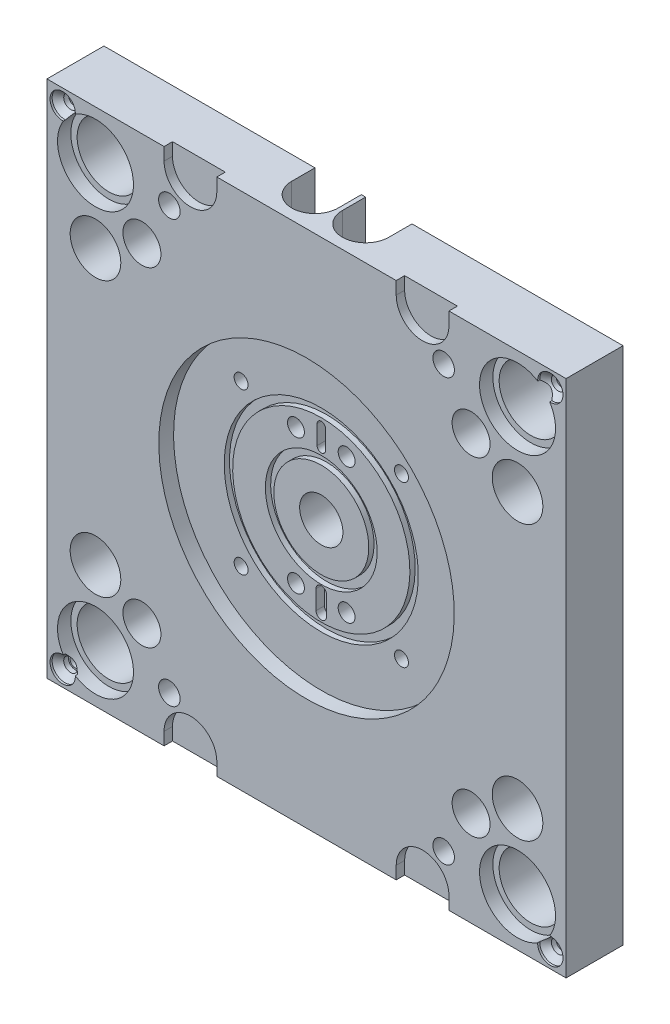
SolidWorks part; units mm, degrees
other "Objet de détail4"
ref_plane "Plan de face" through (0, 0, 0) normal (0, 0, 1) x (1, 0, 0)
ref_plane "Plan de dessus" through (0, 0, 0) normal (0, 1, 0) x (1, 0, 0)
ref_plane "Plan de droite" through (0, 0, 0) normal (1, 0, 0) x (0, 0, -1)
sketch "Esquisse1" plane through (0, 0, 0) normal (0, 0, 1) x (1, 0, 0)
  line L1 (-123, 123) -> (123, 123)
  line L2 (-123, 123) -> (-123, -123)
  line L3 (-123, -123) -> (123, -123)
  line L4 (123, 123) -> (123, -123)
  dimension "D1" = 246
  dimension "D2" = 246
  dimension "D3" = 123
  dimension "D4" = 123
extrude "ExtrusionPlaque" add sketch "Esquisse1" along normal blind 27
sketch "Esquisse2" plane through (0, 0, 0) normal (1, 0, 0) x (0, 0, -1)
  line L0 (2.3658, 0) -> (-28.3416, 0) construction
  line L1 (0, 10.25) -> (-20, 10.25)
  line L2 (0, -123) -> (0, 123) construction
  line L3 (-20, 10.25) -> (-20, 22.5)
  line L4 (-20, 22.5) -> (-17.5, 22.5)
  line L5 (-17.5, 22.5) -> (-17.5, 26.5)
  line L6 (-17.5, 26.5) -> (-20, 26.5)
  line L7 (-20, 26.5) -> (-20, 42)
  line L8 (-20, 42) -> (-17.5, 42)
  line L9 (-17.5, 42) -> (-17.5, 46)
  line L10 (-17.5, 46) -> (-20, 46)
  line L11 (-20, 46) -> (-20, 70)
  line L12 (-20, 70) -> (-27, 70)
  line L13 (-27, -123) -> (-27, 123) construction
  line L14 (-27, 70) -> (-27, 0)
  line L15 (0, 0) -> (-27, 0)
  line L16 (0, 0) -> (0, 10.25)
  dimension "D1" = 20.5
  dimension "D2" = 7
  dimension "D3" = 2.5
  dimension "D4" = 45
  dimension "D5" = 53
  dimension "D6" = 140
  dimension "D7" = 92
  dimension "D8" = 84
revolve "LogementBlocEtJoints" cut sketch "Esquisse2" angle 360 about L0
hole_wizard "ChambrageDouille" positions "Esquisse4" profile "Esquisse3" counterbore size "24" standard "HASCO Metric"
sketch "Esquisse4" plane through (0, 0, 27) normal (0, 0, 1) x (1, 0, 0)
  point P0 (-100, 100)
sketch "Esquisse3" plane through (-100, 100, 27) normal (1, 0, 0) x (0, -1, 0)
  line L0 (0, 0) -> (0, 27)
  line L1 (0, 27) -> (15, 27)
  line L3 (15, 27) -> (15, 6.3)
  line L4 (15, 6.3) -> (18, 6.3)
  line L5 (18, 6.3) -> (18, 0)
  line L7 (18, 0) -> (0, 0)
  line L11 (0, -6.35) -> (0, 107.95) construction
  dimension "Diamètre du perçage jusqu'au prochain" = 30
  dimension "Profondeur du perçage jusqu'au prochain" = 27
  dimension "Diamètre du chambrage" = 36
  dimension "Profondeur du chambrage" = 6.3
pattern_linear "RépétitionChamDouille" count 2 spacing 200 along (1, 0, 0) count 2 spacing 200 along (0, -1, 0) of "ChambrageDouille"
hole_wizard "Chambrage pour Vis épaulée 16 mm1" positions "Esquisse6" profile "Esquisse5" counterbore size "16" standard "HASCO Metric"
sketch "Esquisse6" plane through (0, 0, 27) normal (0, 0, 1) x (1, 0, 0)
  point P0 (-100, 65)
sketch "Esquisse5" plane through (-100, 65, 27) normal (1, 0, 0) x (0, -1, 0)
  line L0 (0, 0) -> (0, 27)
  line L1 (0, 27) -> (8.5, 27)
  line L3 (8.5, 27) -> (8.5, 17)
  line L4 (8.5, 17) -> (12, 17)
  line L5 (12, 17) -> (12, 0)
  line L7 (12, 0) -> (0, 0)
  line L11 (0, -6.35) -> (0, 107.95) construction
  dimension "Diamètre du perçage jusqu'au prochain" = 17
  dimension "Profondeur du perçage jusqu'au prochain" = 27
  dimension "Diamètre du chambrage" = 24
  dimension "Profondeur du chambrage" = 17
pattern_linear "RépétitionChambrage" count 2 spacing 200 along (1, 0, 0) count 2 spacing 130 along (0, -1, 0) of "Chambrage pour Vis épaulée 16 mm1"
hole_wizard "Fraisage pour vis à tête fraisée M101" positions "Esquisse8" profile "Esquisse7" countersink size "M10" standard "HASCO Metric"
sketch "Esquisse8" plane through (0, 0, 27) normal (0, 0, 1) x (1, 0, 0)
  point P0 (-115.555, 115.555)
sketch "Esquisse7" plane through (-115.555, 115.555, 27) normal (1, 0, 0) x (0, -1, 0)
  line L0 (0, 0) -> (0, 6)
  line L1 (0, 6) -> (3.25, 6)
  line L2 (3.25, 6) -> (3.25, 3.75)
  line L3 (3.25, 3.75) -> (6, 1)
  line L4 (6, 1) -> (6, 0)
  line L6 (6, 0) -> (0, 0)
  line L7 (-3.25, 3.75) -> (-6, 1) construction
  line L10 (0, 6) -> (-3.25, 6) construction
  line L11 (0, -6.35) -> (0, 107.95) construction
  dimension "Diamètre du perçage" = 6.5
  dimension "Profondeur du perçage" = 6
  dimension "Diamètre du fraisage" = 12
  dimension "Angle du fraisage" = 90
  dimension "Angle de pointe" = 180
  dimension "Dégagement de la tête" = 1
hole_wizard "Trou taraudé M6x1.01" positions "Esquisse10" profile "Esquisse9" tap size "M6x1.0" standard "HASCO Metric"
sketch "Esquisse10" plane through (0, 0, 21) normal (0, 0, 1) x (1, 0, 0)
  point P0 (-115.555, 115.555)
sketch "Esquisse9" plane through (-115.555, 115.555, 21) normal (1, 0, 0) x (0, -1, 0)
  line L0 (0, 0) -> (0, 22.4434)
  line L1 (0, 22.4434) -> (2.5, 21)
  line L2 (2.5, 21) -> (2.5, 0)
  line L5 (2.5, 0) -> (0, 0)
  line L10 (0, 22.4434) -> (-2.5, 21) construction
  line L11 (0, -6.35) -> (0, 107.95) construction
  dimension "Diamètre du trou pour taraudage" = 5
  dimension "Profondeur du trou pour taraudage" = 21
  dimension "Angle de pointe" = 120
pattern_linear "RépétitionTrouTaraudFraisure" count 2 spacing 231.11 along (1, 0, 0) count 2 spacing 231.11 along (0, -1, 0) of "Fraisage pour vis à tête fraisée M101", "Trou taraudé M6x1.01"
hole_wizard "DégagementTirant" positions "Esquisse12" profile "Esquisse11" hole size "M16" standard "ISO"
sketch "Esquisse12" plane through (0, 0, 27) normal (0, 0, 1) x (1, 0, 0)
  point P0 (-78, 78)
sketch "Esquisse11" plane through (-78, 78, 27) normal (1, 0, 0) x (0, -1, 0)
  line L0 (0, 0) -> (0, 27)
  line L1 (0, 27) -> (9, 27)
  line L2 (9, 27) -> (9, 0)
  line L5 (9, 0) -> (0, 0)
  line L11 (0, -6.35) -> (0, 107.95) construction
  dimension "Diamètre du perçage jusqu'au prochain" = 18
  dimension "Profondeur du perçage jusqu'au prochain" = 27
pattern_linear "RépétitionDégTirant" count 2 spacing 156 along (1, 0, 0) count 2 spacing 156 along (0, -1, 0) of "DégagementTirant"
hole_wizard "TaraudageTirant" positions "Esquisse14" profile "Esquisse13" tap size "M12x1.75" standard "HASCO Metric"
sketch "Esquisse14" plane through (0, 0, 27) normal (0, 0, 1) x (1, 0, 0)
  point P0 (-65, 100)
sketch "Esquisse13" plane through (-65, 100, 27) normal (1, 0, 0) x (0, -1, 0)
  line L0 (0, 0) -> (0, 27.9445)
  line L1 (0, 27.9445) -> (5.1, 25)
  line L2 (5.1, 25) -> (5.1, 0)
  line L5 (5.1, 0) -> (0, 0)
  line L10 (0, 27.9445) -> (-5.1, 25) construction
  line L11 (0, -6.35) -> (0, 107.95) construction
  dimension "Diamètre du trou pour taraudage" = 10.2
  dimension "Profondeur du trou pour taraudage" = 25
  dimension "Angle de pointe" = 120
pattern_linear "RépétitionTaraudTirant" count 2 spacing 130 along (1, 0, 0) count 2 spacing 200 along (0, -1, 0) of "TaraudageTirant"
sketch "Esquisse15" plane through (0, 0, 27) normal (0, 0, 1) x (1, 0, 0)
  line L0 (-42.5, 117) -> (-42.5, 123)
  line L1 (123, 123) -> (-123, 123) construction
  line L2 (-42.5, 123) -> (-67.5, 123)
  line L3 (-67.5, 123) -> (-67.5, 117)
  arc A0 (-67.5, 117) -> (-42.5, 117) centre (-55, 117) ccw
extrude "EncocheDécollementPlaques" cut sketch "Esquisse15" against normal blind 4
pattern_linear "RépétitionEncoche" count 2 spacing 110 along (1, 0, 0) of "EncocheDécollementPlaques"
mirror "SymétrieEncoches" about plane through (0, 0, 0) normal (0, 1, 0) of "RépétitionEncoche", "EncocheDécollementPlaques"
hole_wizard "Perçage8Régul" positions "Esquisse17" profile "Esquisse16" hole size "8" standard "HASCO Metric"
sketch "Esquisse17" plane through (0, 0, 20) normal (0, 0, 1) x (1, 0, 0)
  point P0 (-12, 32)
sketch "Esquisse16" plane through (-12, 32, 20) normal (1, 0, 0) x (0, -1, 0)
  line L0 (0, 0) -> (0, 13)
  line L1 (0, 13) -> (4, 13)
  line L2 (4, 13) -> (4, 0)
  line L5 (4, 0) -> (0, 0)
  line L10 (0, 13) -> (-4, 13) construction
  line L11 (0, -6.35) -> (0, 107.95) construction
  dimension "Diamètre du perçage" = 8
  dimension "Profondeur du perçage" = 13
  dimension "Angle de pointe" = 180
pattern_linear "RépétitionPerçRégul" count 2 spacing 24 along (1, 0, 0) of "Perçage8Régul"
sketch "Esquisse18" plane through (0, 0, 20) normal (0, 0, 1) x (1, 0, 0)
  line L2 (2, 38.5) -> (2, 29.5)
  line L4 (-2, 38.5) -> (-2, 29.5)
  arc A0 (2, 38.5) -> (-2, 38.5) centre (0, 38.5) ccw
  arc A1 (-2, 29.5) -> (2, 29.5) centre (0, 29.5) ccw
  dimension "D3" = 29.5
  dimension "D1" = 9
  dimension "D2" = 4
  dimension "D4" = 2
extrude "LogementBochonSéparation" cut sketch "Esquisse18" against normal blind 4
hole_wizard "ChambrageVisFixationBloc" positions "Esquisse20" profile "Esquisse19" counterbore size "M6" standard "HASCO Metric"
sketch "Esquisse20" plane through (0, 0, 0) normal (0, 0, -1) x (-1, 0, 0)
  point P0 (38, 38)
sketch "Esquisse19" plane through (-38, 38, 0) normal (1, 0, 0) x (0, 1, 0)
  line L0 (0, 0) -> (0, 27)
  line L1 (0, 27) -> (3.3, 27)
  line L3 (3.3, 27) -> (3.3, 6)
  line L4 (3.3, 6) -> (5.5, 6)
  line L5 (5.5, 6) -> (5.5, 0)
  line L7 (5.5, 0) -> (0, 0)
  line L11 (0, -6.35) -> (0, 107.95) construction
  dimension "Diamètre du perçage jusqu'au prochain" = 6.6
  dimension "Profondeur du perçage jusqu'au prochain" = 27
  dimension "Diamètre du chambrage" = 11
  dimension "Profondeur du chambrage" = 6
pattern_linear "RépétitionChamVisBloc" count 2 spacing 76 along (1, 0, 0) count 2 spacing 76 along (0, -1, 0) of "ChambrageVisFixationBloc"
sketch "Esquisse21" plane through (0, 123, 0) normal (0, 1, 0) x (-1, 0, 0)
  line L0 (-123, 0) -> (123, 0) construction
  line L1 (1, 11) -> (1, 0)
  line L2 (1, 0) -> (23, 0)
  line L3 (23, 0) -> (23, 11)
  arc A0 (23, 11) -> (1, 11) centre (12, 11) ccw
  dimension "D3" = 22
  dimension "D1" = 11
  dimension "D2" = 12
extrude "LamageRaccords" cut sketch "Esquisse21" against normal blind 23
hole_wizard "TaraudageRaccordsCircuitRégul" positions "2" profile "3" counterbore size "8" standard "HASCO Metric"
sketch "2" plane through (0, 100, 0) normal (0, 1, 0) x (-1, 0, 0)
  point P0 (12, 11)
sketch "3" plane through (-12, 100, 11) normal (1, 0, 0) x (0, 0, 1)
  line L0 (0, 0) -> (0, 128)
  line L1 (0, 128) -> (4, 128)
  line L3 (4, 128) -> (4, 13)
  line L4 (4, 13) -> (5.75, 13)
  line L5 (5.75, 13) -> (5.75, 0)
  line L7 (5.75, 0) -> (0, 0)
  line L11 (0, -6.35) -> (0, 107.95) construction
  dimension "Diamètre du perçage jusqu'au prochain" = 8
  dimension "Profondeur du perçage jusqu'au prochain" = 128
  dimension "Diamètre du chambrage" = 11.5
  dimension "Profondeur du chambrage" = 13
mirror "SymétrieTarRaccordCircuitRégul" about plane through (0, 0, 0) normal (1, 0, 0) of "TaraudageRaccordsCircuitRégul", "LamageRaccords"
hole_wizard "SOL2_PerçageRégul" positions "Esquisse25" profile "Esquisse24" hole size "M8" standard "ISO"
sketch "Esquisse25" plane through (123, 0, 0) normal (1, 0, 0) x (0, 0, -1)
  line L0 (0, -123) -> (0, 123) construction
  point P0 (-11, -28)
  point P9 (0, 0)
  dimension "D1" = 28
sketch "Esquisse24" plane through (123, -28, 11) normal (0, 1, 0) x (0, 0, -1)
  line L0 (0, 0) -> (0, 177.4034)
  line L1 (0, 177.4034) -> (4, 175)
  line L2 (4, 175) -> (4, 0)
  line L5 (4, 0) -> (0, 0)
  line L10 (0, 177.4034) -> (-4, 175) construction
  line L11 (0, -6.35) -> (0, 107.95) construction
  dimension "Diamètre du perçage" = 8
  dimension "Profondeur du perçage" = 175
  dimension "Angle de pointe" = 118
sketch "1" plane through (-38.0763, 123, -1.191) normal (0, 1, 0) x (-1, 0, 0)
  line L1 (-1.0763, 12.191) -> (-1.0763, 0.691)
  line L2 (-1.0763, 0.691) -> (20.9237, 0.691)
  line L3 (20.9237, 0.691) -> (20.9237, 12.191)
  line L4 (-15.0763, 1.191) -> (84.9237, 1.191) construction
  arc A0 (20.9237, 12.191) -> (-1.0763, 12.191) centre (9.9237, 12.191) ccw
  dimension "D3" = 22
  dimension "D1" = 48
  dimension "D2" = 11
extrude "SOL2_LamageRaccord" [suppressed] cut sketch "1" against normal blind 23
hole_wizard "SOL2_TaraudageRaccordCircuitRégul" positions "2" profile "3" counterbore size "8" standard "HASCO Metric"
sketch "2" [suppressed] plane through (-38.0763, 100, -1.191) normal (0, 1, 0) x (-1, 0, 0)
  arc A0 (20.9237, 12.191) -> (-1.0763, 12.191) centre (9.9237, 12.191) ccw construction
  point P0 (9.9237, 12.191)
sketch "3" plane through (-48, 100, 11) normal (1, 0, 0) x (0, 0, 1)
  line L0 (0, 0) -> (0, 223.001)
  line L1 (0, 223.001) -> (4, 223.001)
  line L3 (4, 223.001) -> (4, 13)
  line L4 (4, 13) -> (5.75, 13)
  line L5 (5.75, 13) -> (5.75, 0)
  line L7 (5.75, 0) -> (0, 0)
  line L11 (0, -6.35) -> (0, 107.95) construction
  dimension "Diamètre du perçage jusqu'au prochain" = 8
  dimension "Profondeur du perçage jusqu'au prochain" = 223.001
  dimension "Diamètre du chambrage" = 11.5
  dimension "Profondeur du chambrage" = 13
mirror "SOL2_SymLamTarRaccCircRégul" [suppressed] about plane through (0, 0, 0) normal (1, 0, 0)
mirror "SOL2_SymPerç8RégulEtLogemBouchon" [suppressed] about plane through (0, 0, 0) normal (0, 1, 0)
sketch "Esquisse27" plane through (0, 0, 20) normal (0, 0, 1) x (1, 0, 0)
  line L2 (2.5, -38) -> (2.5, -30)
  line L4 (-2.5, -38) -> (-2.5, -30)
  arc A0 (2.5, -30) -> (-2.5, -30) centre (0, -30) ccw
  arc A1 (-2.5, -38) -> (2.5, -38) centre (0, -38) ccw
  dimension "D1" = 2.5
  dimension "D2" = 2.5
  dimension "D3" = 8
  dimension "D4" = 30
  dimension "D5" = 2.5
  dimension "D6" = 5
extrude "SOL2_RainureDétrompage" [suppressed] cut sketch "Esquisse27" against normal blind 4
mirror "SOL1_SymRégulExistante" about plane through (0, 0, 0) normal (0, 1, 0) of "RépétitionPerçRégul", "LogementBochonSéparation", "LamageRaccords", "TaraudageRaccordsCircuitRégul", "SymétrieTarRaccordCircuitRégul", "Perçage8Régul"
sketch "Esquisse26" plane through (0, 0, 16) normal (0, 0, 1) x (1, 0, 0)
  line L4 (2.5, -38.5) -> (2.5, -29.5)
  line L5 (-2.5, -29.5) -> (-2.5, -38.5)
  line L6 (2.5, -38.5) -> (2.5, -29.5)
  line L7 (-2.5, -29.5) -> (-2.5, -38.5)
  arc A4 (-2.5, -38.5) -> (2.5, -38.5) centre (0, -38.5) ccw
  arc A5 (2.5, -29.5) -> (-2.5, -29.5) centre (0, -29.5) ccw
  arc A6 (-2.5, -38.5) -> (2.5, -38.5) centre (0, -38.5) ccw
  arc A7 (2.5, -29.5) -> (-2.5, -29.5) centre (0, -29.5) ccw
  dimension "D1" = 0.5
extrude "SOL1_RainureDétrompage" cut sketch "Esquisse26" along normal through all
